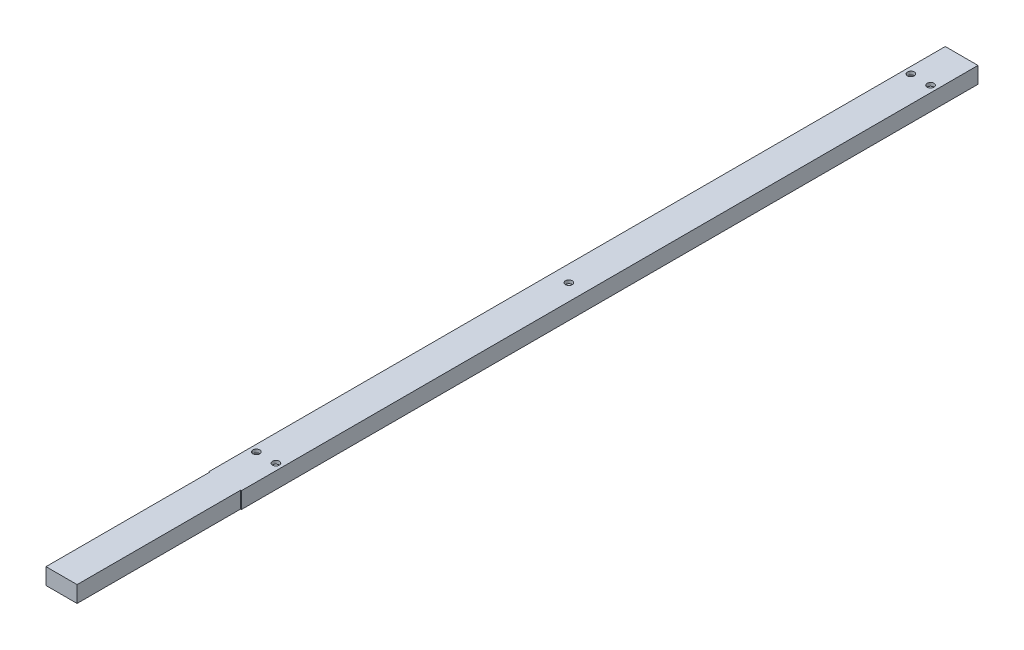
SolidWorks part; units mm, degrees
ref_plane "前视基准面" through (0, 0, 0) normal (0, 0, 1) x (1, 0, 0)
ref_plane "上视基准面" through (0, 0, 0) normal (0, 1, 0) x (1, 0, 0)
ref_plane "右视基准面" through (0, 0, 0) normal (1, 0, 0) x (0, 0, -1)
sketch "草图1" plane through (0, 0, 0) normal (0, 0, 1) x (1, 0, 0)
  line L1 (-10, 5) -> (10, 5)
  line L2 (-10, 5) -> (-10, -5)
  line L3 (-10, -5) -> (10, -5)
  line L4 (10, 5) -> (10, -5)
  line L5 (-10, 5) -> (10, -5) construction
  line L6 (-10, -5) -> (10, 5) construction
  line L7 (-8, 3) -> (8, 3)
  line L8 (-8, 3) -> (-8, -3)
  line L9 (-8, -3) -> (8, -3)
  line L10 (8, 3) -> (8, -3)
  line L11 (-8, 3) -> (8, -3) construction
  line L12 (-8, -3) -> (8, 3) construction
  point P0 (0, 0)
  point P6 (0, 0)
  dimension "D1" = 20
  dimension "D2" = 10
  dimension "D3" = 2
  dimension "D4" = 2
extrude "凸台-拉伸1" add sketch "草图1" along normal blind 450
hole_wizard "Ø4.2 (4.2) 直径孔1" positions "草图2" profile "草图3" hole size "Ø4.2" standard "GB"
sketch "草图2" plane through (0, 5, 0) normal (0, 1, 0) x (1, 0, 0)
  line L0 (10, -450) -> (10, 0) construction
  point P0 (-6, -425)
  point P2 (6, -425)
  point P4 (-6, -25)
  point P6 (6, -25)
  point P11 (10, -225)
  point P12 (0, 0)
  point P13 (0, 0)
  dimension "D1" = 400
  dimension "D2" = 200
  dimension "D3" = 12
  dimension "D4" = 12
  dimension "D5" = 6
  dimension "D6" = 6
sketch "草图3" plane through (-6, 5, 425) normal (1, 0, 0) x (0, 0, 1)
  line L0 (0, 0) -> (0, 10)
  line L1 (0, 10) -> (2.1, 10)
  line L2 (2.1, 10) -> (2.1, 0)
  line L5 (2.1, 0) -> (0, 0)
  line L11 (0, -6.35) -> (0, 107.95) construction
  dimension "通孔孔直径" = 4.2
  dimension "通孔孔深度" = 10
hole_wizard "Ø4.2 (4.2) 直径孔2" positions "草图4" profile "草图5" hole size "Ø4.2" standard "GB"
sketch "草图4" plane through (0, -5, 0) normal (0, -1, 0) x (-1, 0, 0)
  line L1 (-10, -450) -> (-10, 0) construction
  line L2 (-10, -450) -> (10, -450) construction
  point P0 (0, -240)
  point P7 (0, 0)
  dimension "D1" = 10
  dimension "D2" = 210
sketch "草图5" plane through (0, -5, 240) normal (1, 0, 0) x (0, 0, -1)
  line L0 (0, 0) -> (0, 10)
  line L1 (0, 10) -> (2.1, 10)
  line L2 (2.1, 10) -> (2.1, 0)
  line L5 (2.1, 0) -> (0, 0)
  line L11 (0, -6.35) -> (0, 107.95) construction
  dimension "通孔孔直径" = 4.2
  dimension "通孔孔深度" = 10
sketch "草图8" plane through (0, 0, 450) normal (0, 0, -1) x (-1, 0, 0)
  line L1 (-9.5, 5) -> (9.5, 5)
  line L2 (-9.5, 5) -> (-9.5, -5)
  line L3 (-9.5, -5) -> (9.5, -5)
  line L4 (9.5, 5) -> (9.5, -5)
  line L5 (-9.5, 5) -> (9.5, -5) construction
  line L6 (-9.5, -5) -> (9.5, 5) construction
  point P0 (0, 0)
  dimension "D1" = 19
  dimension "D2" = 10
extrude "凸台-拉伸2" add sketch "草图8" against normal blind 100
